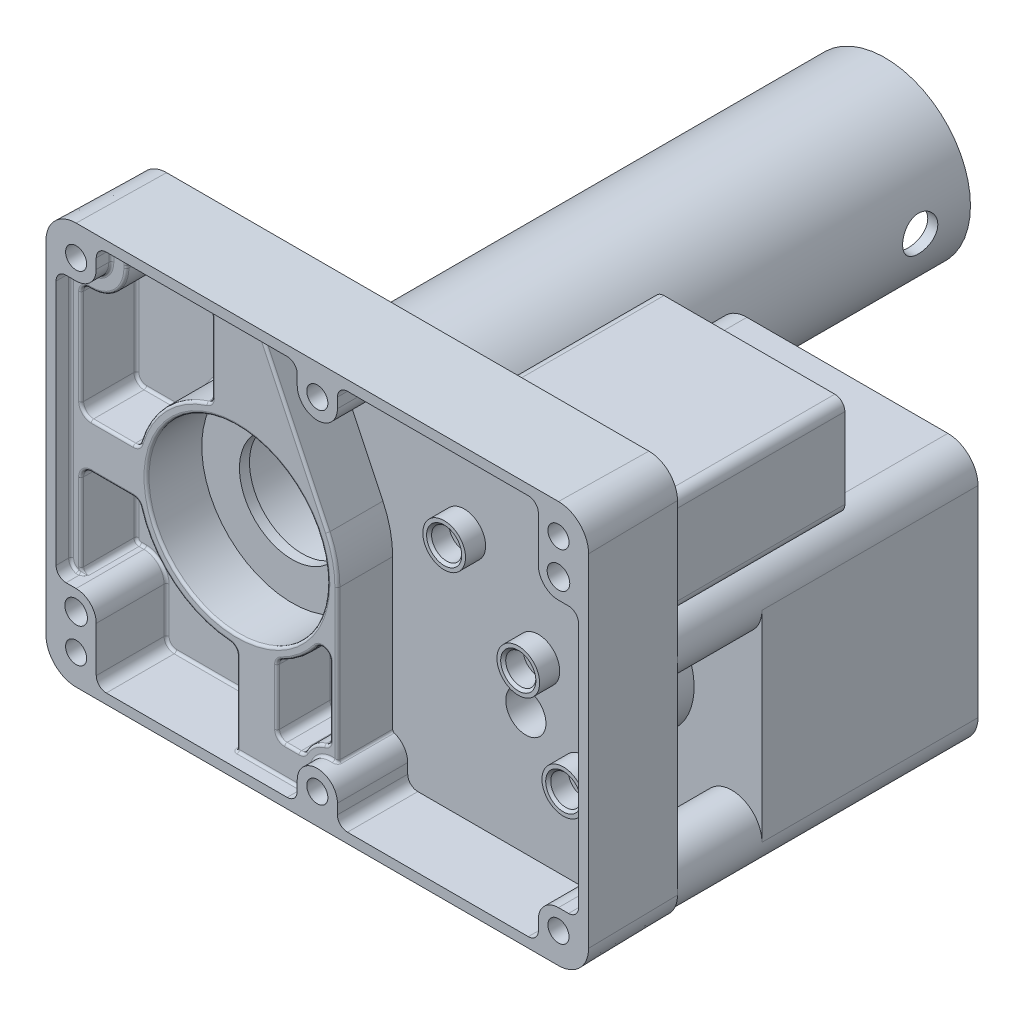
SolidWorks part; units mm, degrees
ref_plane "Plan de face" through (0, 0, 0) normal (0, 0, 1) x (1, 0, 0)
ref_plane "Plan de dessus" through (0, 0, 0) normal (0, 1, 0) x (1, 0, 0)
ref_plane "Plan de droite" through (0, 0, 0) normal (1, 0, 0) x (0, 0, -1)
sketch "Esquisse1" plane through (0, 0, 0) normal (0, 0, 1) x (1, 0, 0)
  circle A0 centre (0, 0) radius 15
  dimension "D1" = 30
extrude "Extru.-Mince1" add sketch "Esquisse1" along normal blind 110 thin
sketch "Esquisse2" plane through (0, 0, 110) normal (0, 0, 1) x (1, 0, 0)
  circle A0 centre (0, 0) radius 30
  dimension "D1" = 60
extrude "Extrusion1" add sketch "Esquisse2" along normal blind 4
sketch "Esquisse3" plane through (0, 0, 114) normal (0, 0, 1) x (1, 0, 0)
  line L0 (0, 0) -> (-63.7634, 0) construction
  line L1 (67, 40) -> (-29, 40)
  line L2 (73, 34) -> (73, -34)
  line L3 (67, -40) -> (-29, -40)
  line L4 (-35, 34) -> (-35, -34)
  line L5 (-35, 0) -> (73, 0) construction
  arc A0 (67, 40) -> (73, 34) centre (67, 34) cw
  arc A1 (-29, 40) -> (-35, 34) centre (-29, 34) ccw
  arc A2 (-29, -40) -> (-35, -34) centre (-29, -34) cw
  arc A3 (73, -34) -> (67, -40) centre (67, -34) cw
  point P11 (73, 40)
  point P14 (-35, 40)
  dimension "D4" = 6
  dimension "D1" = 108
  dimension "D2" = 35
  dimension "D3" = 80
extrude "Extrusion2" add sketch "Esquisse3" along normal blind 18
sketch "Esquisse5" plane through (0, 0, 0) normal (1, 0, 0) x (0, 0, -1)
  line L0 (0, 0) -> (-52.0358, 0) construction
  line L1 (0, -17) -> (0, 17) construction
  circle A0 centre (-10, 0) radius 3.5
  dimension "D2" = 7
  dimension "D1" = 10
extrude "Enlèv. mat.-Extru.1" cut sketch "Esquisse5" against normal through all and the other way through all
sketch "Esquisse6" plane through (0, 0, 0) normal (0, 0, 1) x (1, 0, 0)
  circle A1 centre (0, 0) radius 15
  circle A2 centre (0, 0) radius 15 construction
extrude "Enlèv. mat.-Extru.2" cut sketch "Esquisse6" along normal blind 116
sketch "Esquisse9" plane through (0, 0, 114) normal (0, 0, -1) x (-1, 0, 0)
  line L2 (-66.5, 6.5) -> (-66.5, -33.5) construction
  line L3 (-66.5, -13.5) -> (-26.5, -13.5) construction
  line L4 (-26.5, 6.5) -> (-26.5, -33.5) construction
  line L5 (-46.5, -13.5) -> (-46.5, -16.0296) construction
  line L6 (-73, -34) -> (-73, 34) construction
  line L7 (29, -40) -> (-67, -40) construction
  circle A0 centre (-66.5, 6.5) radius 6
  circle A1 centre (-26.5, 6.5) radius 6
  circle A2 centre (-66.5, -33.5) radius 6
  circle A3 centre (-26.5, -33.5) radius 6
  circle A4 centre (-46.5, -13.5) radius 12.5
  dimension "D3" = 6
  dimension "D4" = 25
  dimension "D5" = 6.5
  dimension "D1" = 40
  dimension "D2" = 40
  dimension "D6" = 6.5
sketch "Esquisse8" plane through (0, 0, 114) normal (0, 0, -1) x (-1, 0, 0)
  line L1 (-33, 13) -> (-71, 13)
  line L2 (-33, 13) -> (-33, 33)
  line L3 (-33, 33) -> (-71, 33)
  line L4 (-71, 13) -> (-71, 33)
  line L5 (-73, -34) -> (-73, 34) construction
  line L6 (-67, 40) -> (29, 40) construction
  dimension "D1" = 38
  dimension "D2" = 20
  dimension "D3" = 2
  dimension "D4" = 27
extrude "Extrusion4" add sketch "Esquisse8" along normal blind 35
fillet "Congé1" radius 2 3 edges at (33, 33, 96.5) (71, 13, 96.5) (71, 33, 96.5)
ref_plane "Plan2" through (-17, 0, 0) normal (1, 0, 0) x (0, 0, -1)
extrude "Boss.-Extru.4" add sketch "Esquisse9" along normal blind 17
sketch "Esquisse10" plane through (0, 0, 97) normal (0, 0, -1) x (-1, 0, 0)
  line L0 (-66.5, -39.5) -> (-26.5, -39.5)
  line L1 (-20.5, 6.5) -> (-20.5, -33.5)
  line L2 (-72.5, 6.5) -> (-72.5, -33.5)
  line L3 (-66.5, 12.5) -> (-26.5, 12.5)
  circle A0 centre (-66.5, 6.5) radius 6 construction
  circle A1 centre (-66.5, -33.5) radius 6 construction
  circle A2 centre (-26.5, 6.5) radius 6 construction
  circle A3 centre (-26.5, -33.5) radius 6 construction
  arc A4 (-66.5, 12.5) -> (-72.5, 6.5) centre (-66.5, 6.5) ccw
  arc A5 (-72.5, -33.5) -> (-66.5, -39.5) centre (-66.5, -33.5) ccw
  arc A6 (-20.5, 6.5) -> (-26.5, 12.5) centre (-26.5, 6.5) ccw
  arc A7 (-26.5, -39.5) -> (-20.5, -33.5) centre (-26.5, -33.5) ccw
extrude "Boss.-Extru.5" add sketch "Esquisse10" along normal blind 43
draft "Dépouille1" draft angle 1 faces to draft 8 parameters "D1"=1
hole_wizard "Trou taraudé M51" positions "Esquisse12" profile "Esquisse11" tap size "M5" standard "ISO"
sketch "Esquisse12" plane through (0, 0, 132) normal (0, 0, 1) x (1, 0, 0)
  line L0 (73, -34) -> (-35, -34) construction
  line L1 (123.3954, 34) -> (-93.4295, 34) construction
  line L2 (67, 40) -> (-29, 40) construction
  line L3 (-29, -40) -> (67, -40) construction
  line L4 (73, -34) -> (73, 34) construction
  line L5 (-35, 34) -> (-35, -34) construction
  point P0 (19, 34)
  point P1 (67, -34)
  point P3 (19, -34)
  point P5 (-29, -34)
  point P7 (-29, 34)
  point P9 (67, 34)
  dimension "D1" = 6
  dimension "D2" = 6
  dimension "D3" = 6
  dimension "D4" = 6
sketch "Esquisse11" plane through (19, 34, 132) normal (1, 0, 0) x (0, -1, 0)
  line L0 (0, 0) -> (0, 15.2618)
  line L1 (0, 15.2618) -> (2.1, 14)
  line L2 (2.1, 14) -> (2.1, 0)
  line L5 (2.1, 0) -> (0, 0)
  line L10 (0, 15.2618) -> (-2.1, 14) construction
  line L11 (0, -6.35) -> (0, 107.95) construction
  dimension "Diamètre du trou pour taraudage" = 4.2
  dimension "Profondeur du trou pour taraudage" = 14
  dimension "Angle de pointe" = 118
hole_wizard "Diamètre du perçage Ø4.5 (4.5)1" positions "Esquisse14" profile "Esquisse13" hole size "Ø4.5" standard "ISO"
sketch "Esquisse14" plane through (0, 0, 132) normal (0, 0, 1) x (1, 0, 0)
  point P0 (67, 27)
  point P1 (-29, -27)
  dimension "D1" = 7
  dimension "D2" = 7
sketch "Esquisse13" plane through (67, 27, 132) normal (1, 0, 0) x (0, -1, 0)
  line L0 (0, 0) -> (0, 11.3519)
  line L1 (0, 11.3519) -> (2.25, 10)
  line L2 (2.25, 10) -> (2.25, 0)
  line L5 (2.25, 0) -> (0, 0)
  line L10 (0, 11.3519) -> (-2.25, 10) construction
  line L11 (0, -6.35) -> (0, 107.95) construction
  dimension "Diamètre du perçage" = 4.5
  dimension "Profondeur du perçage" = 10
  dimension "Angle de pointe" = 118
sketch "Esquisse15" plane through (0, 0, 132) normal (0, 0, 1) x (1, 0, 0)
  line L0 (15, -34) -> (15, -36)
  line L1 (23, 34) -> (23, 36)
  line L2 (25, -38) -> (61, -38)
  line L3 (67, 23) -> (69, 23)
  line L4 (-31, 30) -> (-29, 30)
  line L5 (13, 38) -> (-23, 38)
  line L6 (-25, 36) -> (-25, 34)
  line L7 (63, 36) -> (63, 27)
  line L8 (67, 38) -> (-29, 38)
  line L9 (-33, 34) -> (-33, -34)
  line L10 (-29, -38) -> (67, -38)
  line L11 (71, -34) -> (71, 34)
  line L12 (61, 38) -> (25, 38)
  line L13 (-33, 28) -> (-33, -21)
  line L14 (-23, -38) -> (13, -38)
  line L15 (71, -28) -> (71, 21)
  line L17 (-31, -23) -> (-29, -23)
  line L18 (15, 36) -> (15, 34)
  line L19 (23, -36) -> (23, -34)
  line L21 (-25, -27) -> (-25, -36)
  line L22 (67, -30) -> (69, -30)
  line L23 (63, -34) -> (63, -36)
  arc A0 (15, 36) -> (13, 38) centre (13, 36) ccw
  arc A1 (25, 38) -> (23, 36) centre (25, 36) ccw
  arc A2 (61, 38) -> (63, 36) centre (61, 36) cw
  arc A3 (69, 23) -> (71, 21) centre (69, 21) cw
  arc A4 (-29, 30) -> (-25, 34) centre (-29, 34) ccw
  arc A5 (15, 34) -> (23, 34) centre (19, 34) ccw
  arc A6 (69, -30) -> (71, -28) centre (69, -28) ccw
  arc A7 (67, -30) -> (63, -34) centre (67, -34) ccw
  arc A8 (71, 34) -> (67, 38) centre (67, 34) ccw
  arc A9 (-29, 38) -> (-33, 34) centre (-29, 34) ccw
  arc A10 (-33, -34) -> (-29, -38) centre (-29, -34) ccw
  arc A11 (67, -38) -> (71, -34) centre (67, -34) ccw
  arc A12 (61, -38) -> (63, -36) centre (61, -36) ccw
  arc A13 (23, -36) -> (25, -38) centre (25, -36) ccw
  arc A14 (13, -38) -> (15, -36) centre (13, -36) ccw
  arc A15 (-23, -38) -> (-25, -36) centre (-23, -36) cw
  arc A16 (23, -34) -> (15, -34) centre (19, -34) ccw
  arc A17 (-33, -21) -> (-31, -23) centre (-31, -21) ccw
  arc A18 (-25, -27) -> (-29, -23) centre (-29, -27) ccw
  arc A19 (63, 27) -> (67, 23) centre (67, 27) ccw
  arc A20 (-31, 30) -> (-33, 28) centre (-31, 28) ccw
  arc A21 (-23, 38) -> (-25, 36) centre (-23, 36) ccw
  point P39 (15, 38)
  point P59 (23, -38)
  dimension "D2" = 2
  dimension "D1" = 2
extrude "Enlèv. mat.-Extru.3" cut sketch "Esquisse15" against normal blind 14
sketch "Esquisse16" plane through (0, 0, 118) normal (0, 0, 1) x (1, 0, 0)
  circle A0 centre (0, 0) radius 10.5
  circle A1 centre (46.5, -13.5) radius 4
  dimension "D1" = 21
  dimension "D2" = 8
extrude "Enlèv. mat.-Extru.4" cut sketch "Esquisse16" against normal blind 10
sketch "Esquisse17" plane through (0, 0, 118) normal (0, 0, 1) x (1, 0, 0)
  line L0 (0, 0) -> (-54.3108, 0) construction
  line L1 (-20.6458, 4.5) -> (-29, 4.5)
  line L2 (-20.6458, -4.5) -> (-29, -4.5)
  line L3 (5, 36.3391) -> (5, 37)
  line L4 (0, 4.5) -> (-54.3108, 4.5) construction
  line L5 (0, -4.5) -> (-54.3108, -4.5) construction
  line L6 (-31, -6.5) -> (-31, -22)
  line L7 (-33, 28) -> (-33, -21) construction
  line L8 (-33, 28) -> (-33, -21)
  line L9 (-31, 28) -> (-31, -21)
  line L10 (-31, 25.5) -> (-31, 6.5)
  line L11 (5.1459, 35.6939) -> (18.0549, 8.6035)
  line L12 (-22, 34) -> (-22, 34.5)
  line L13 (20, 0) -> (20, -30.127)
  line L14 (-31, -23) -> (-30, -23)
  line L15 (-29, 27) -> (-29.5, 27)
  line L16 (-23, -38) -> (13, -38) construction
  line L17 (13, 38) -> (-23, 38) construction
  line L18 (-25, 36) -> (-25, 34) construction
  line L19 (-29, 30) -> (-31, 30) construction
  line L20 (6, 38) -> (-23, 38)
  line L21 (-25, 36) -> (-25, 34)
  line L22 (-29, 30) -> (-31, 30)
  line L23 (0, 0) -> (0, 54.442) construction
  line L24 (-5, 20.4939) -> (-5, 34.5)
  line L25 (-6.5, 36) -> (-20.5, 36)
  line L26 (-5, 0) -> (-5, 54.442) construction
  line L27 (15, -36) -> (15, -34) construction
  line L28 (0, -38) -> (13, -38)
  line L29 (15, -36) -> (15, -34)
  line L30 (0, -21.4476) -> (0, -38)
  line L31 (-23, -38) -> (13, -38) construction
  line L32 (18.5, -13.1624) -> (18.5, -26.7716)
  line L33 (8, -19.2873) -> (8, -30.5)
  line L34 (9.5, -32) -> (12.3668, -32)
  line L35 (-23, -32) -> (13, -32) construction
  line L37 (18.5, 0) -> (18.5, -46.5443) construction
  line L40 (20, 0) -> (20, -46.5443) construction
  arc A0 (13, -38) -> (15, -36) centre (13, -36) ccw construction
  arc A1 (-19.2054, -5.5814) -> (-1.3953, -19.9513) centre (0, 0) ccw
  arc A2 (-33, -21) -> (-31, -23) centre (-31, -21) ccw construction
  circle A3 centre (0, 0) radius 18
  circle A4 centre (0, 0) radius 20 construction
  arc A5 (23, -34) -> (15, -34) centre (19, -34) ccw construction
  arc A6 (-33, -21) -> (-31, -23) centre (-31, -21) ccw
  arc A7 (-23, 38) -> (-25, 36) centre (-23, 36) ccw construction
  arc A8 (13, -38) -> (15, -36) centre (13, -36) ccw
  arc A9 (-29, 30) -> (-25, 34) centre (-29, 34) ccw construction
  arc A10 (-29, 27) -> (-22, 34) centre (-29, 34) ccw
  arc A11 (-29, 27) -> (-22, 34) centre (-29, 34) ccw
  arc A12 (-31, 30) -> (-33, 28) centre (-31, 28) ccw construction
  arc A13 (-23, 38) -> (-25, 36) centre (-23, 36) ccw
  arc A14 (-29, 30) -> (-25, 34) centre (-29, 34) ccw
  arc A15 (-31, 30) -> (-33, 28) centre (-31, 28) ccw
  arc A16 (-6.0465, 19.0641) -> (-19.2054, 5.5814) centre (0, 0) ccw
  arc A17 (20, -30.127) -> (15, -34) centre (19, -34) ccw
  arc A18 (8.8372, -17.9417) -> (15.814, -12.2441) centre (0, 0) ccw
  arc A19 (-29, -4.5) -> (-31, -6.5) centre (-29, -6.5) ccw
  arc A20 (20, 0) -> (18.0549, 8.6035) centre (0, 0) ccw
  arc A21 (17.4, -28.2173) -> (13.6934, -31.2) centre (19, -34) ccw
  arc A22 (-29, 4.5) -> (-31, 6.5) centre (-29, 6.5) cw
  arc A23 (-31, -22) -> (-30, -23) centre (-30, -22) ccw
  arc A24 (18.5, -13.1624) -> (15.814, -12.2441) centre (17, -13.1624) ccw
  arc A25 (18.5, -26.7716) -> (17.4, -28.2173) centre (17, -26.7716) cw
  arc A26 (12.3668, -32) -> (13.6934, -31.2) centre (12.3668, -30.5) ccw
  arc A27 (8, -30.5) -> (9.5, -32) centre (9.5, -30.5) ccw
  arc A28 (8, -19.2873) -> (8.8372, -17.9417) centre (9.5, -19.2873) cw
  arc A29 (-1.3953, -19.9513) -> (0, -21.4476) centre (-1.5, -21.4476) cw
  arc A30 (-20.6458, -4.5) -> (-19.2054, -5.5814) centre (-20.6458, -6) cw
  arc A31 (-20.6458, 4.5) -> (-19.2054, 5.5814) centre (-20.6458, 6) ccw
  arc A32 (-5, 20.4939) -> (-6.0465, 19.0641) centre (-6.5, 20.4939) cw
  arc A33 (5.1459, 35.6939) -> (5, 36.3391) centre (6.5, 36.3391) cw
  arc A34 (-5, 34.5) -> (-6.5, 36) centre (-6.5, 34.5) ccw
  arc A35 (-22, 34.5) -> (-20.5, 36) centre (-20.5, 34.5) cw
  arc A36 (-31, 25.5) -> (-29.5, 27) centre (-29.5, 25.5) cw
  arc A37 (6, 38) -> (5, 37) centre (6, 37) ccw
  point P12 (20, 0)
  point P43 (0, -45.0495)
  point P45 (5, 0)
  point P46 (5, 54.442)
  point P56 (25, -34)
  point P57 (13, -34)
  point P60 (13, -36)
  point P61 (-23, -36)
  point P64 (8, 0)
  point P65 (8, -45.0495)
  point P75 (-31, -4.5)
  point P92 (8, -18.3303)
  point P101 (-5, 19.3649)
  point P104 (5, 36)
  dimension "D1" = 36
  dimension "D12" = 2
  dimension "D14" = 2
  dimension "D15" = 2
  dimension "D16" = 1.5
  dimension "D17" = 2
  dimension "D5" = 2
  dimension "D9" = 5
  dimension "D10" = 8
  dimension "D2" = 2
  dimension "D3" = 4.5
  dimension "D4" = 4.5
  dimension "D6" = 2
  dimension "D7" = 3
  dimension "D8" = 5
  dimension "D11" = 1.5
  dimension "D13" = 6
extrude "Boss.-Extru.6" add sketch "Esquisse17" along normal blind 11
sketch "Esquisse18" plane through (0, 0, 118) normal (0, 0, 1) x (1, 0, 0)
  line L0 (73, 0) -> (-39.77, 0) construction
  line L1 (73, -34) -> (73, 34) construction
  circle A0 centre (46.5, -13.5) radius 2.83 construction
  circle A1 centre (57.9592, -19.5) radius 10.105 construction
  circle A2 centre (57.9592, -19.5) radius 5.89 construction
  circle A3 centre (49, -3.1429) radius 12.76 construction
  circle A4 centre (49, -3.1429) radius 6 construction
  circle A5 centre (34.2485, 11.0924) radius 14.5 construction
  circle A6 centre (34.2485, 11.0924) radius 6 construction
  circle A7 centre (0, 0) radius 30 construction
  circle A8 centre (34.2485, 11.0924) radius 3
  circle A9 centre (49, -3.1429) radius 3
  circle A10 centre (57.9592, -19.5) radius 3
  circle A11 centre (34.2485, 11.0924) radius 4.25
  circle A12 centre (49, -3.1429) radius 4.25
  circle A13 centre (57.9592, -19.5) radius 4.25
  dimension "D1" = 5.66
  dimension "D2" = 20.21
  dimension "D3" = 11.78
  dimension "D4" = 25.52
  dimension "D5" = 12
  dimension "D6" = 29
  dimension "D7" = 12
  dimension "D8" = 60
  dimension "D9" = 6
  dimension "D11" = 6
  dimension "D12" = 8.5
  dimension "D10" = 24
extrude "Boss.-Extru.7" add sketch "Esquisse18" along normal blind 4
chamfer "Chanfrein1" distance 0.5 angle 45 3 edges at (60.9592, -19.5, 122) (52, -3.1429, 122) (37.2485, 11.0924, 122)
fillet "Congé4" radius 0.5 90 edges at (-22, 34.25, 118) (-21.5607, 35.5607, 118) (-13.5, 36, 118) (-5.4393, 35.5607, 118) (-5, 27.497, 118) (-5.2896, 19.608, 118) (-14.313, 13.9692, 118) (-19.7452, 4.8004, 118) (-24.8229, 4.5, 118) (-30.4142, 5.0858, 118) (-31, 16, 118) (-30.5607, 26.5607, 118) (-29.25, 27, 118) (-24.0503, 29.0503, 118) (-30.4142, -5.0858, 118) (-24.8229, -4.5, 118) (-19.7452, -4.8004, 118) (-12.5587, -15.5653, 118) (-0.403, -20.4246, 118) (0, -29.7238, 118) (-11.5, -38, 118) (-24.4142, -37.4142, 118) (-25, -31.5, 118) (-26.1716, -24.1716, 118) (-29.5, -23, 118) (-30.7071, -22.7071, 118) (-31, -14.25, 118) (18.5, -19.967, 118) (18.1937, -27.6799, 118) (15.2384, -29.3255, 118) (13.1413, -31.7845, 118) (10.9334, -32, 118) (8.4393, -31.5607, 118) (8, -24.8937, 118) (8.2264, -18.4949, 118) (12.6505, -15.4908, 118) (17.4852, -11.7431, 118) (20, -30.127, 123.5) (0, -38, 123.5) (8.2264, -18.4949, 129) (8, -24.8937, 129) (8.4393, -31.5607, 129) (10.9334, -32, 129) (13.1413, -31.7845, 129) (15.2384, -29.3255, 129) (18.1937, -27.6799, 129) (18.5, -19.967, 129) (17.4852, -11.7431, 129) (12.6505, -15.4908, 129) (18, 0, 129) (-30, 30, 129) (-26.1716, 31.1716, 129) (-25, 35, 129) (-24.4142, 37.4142, 129) (-8.5, 38, 129) (5.2929, 37.7071, 129) (5, 36.6696, 129) (5.0369, 36.0083, 129) (11.6004, 22.1487, 129) (19.5077, 4.4103, 129) (20, -15.0635, 129) (16.5505, -30.8377, 129) (15, -35, 129) (14.4142, -37.4142, 129) (6.5, -38, 129) (0, -29.7238, 129) (-0.403, -20.4246, 129) (-12.5587, -15.5653, 129) (-19.7452, -4.8004, 129) (-24.8229, -4.5, 129) (-30.4142, -5.0858, 129) (-31, -14.25, 129) (-30.7071, -22.7071, 129) (-32.4142, -22.4142, 129) (-33, 3.5, 129) (-32.4142, 29.4142, 129) (-30.5607, 26.5607, 129) (-31, 16, 129) (-30.4142, 5.0858, 129) (-24.8229, 4.5, 129) (-19.7452, 4.8004, 129) (-14.313, 13.9692, 129) (-5.2896, 19.608, 129) (-5, 27.497, 129) (-5.4393, 35.5607, 129) (-13.5, 36, 129) (-21.5607, 35.5607, 129) (-22, 34.25, 129) (-24.0503, 29.0503, 129) (-29.25, 27, 129)
sketch "Points axes de rotations" plane through (0, 0, 118) normal (0, 0, 1) x (1, 0, 0)
  point P0 (0, 0)
  point P1 (34.2485, 11.0924)
  point P3 (49, -3.1429)
  point P5 (57.9592, -19.5)
  point P7 (46.5, -13.5)
